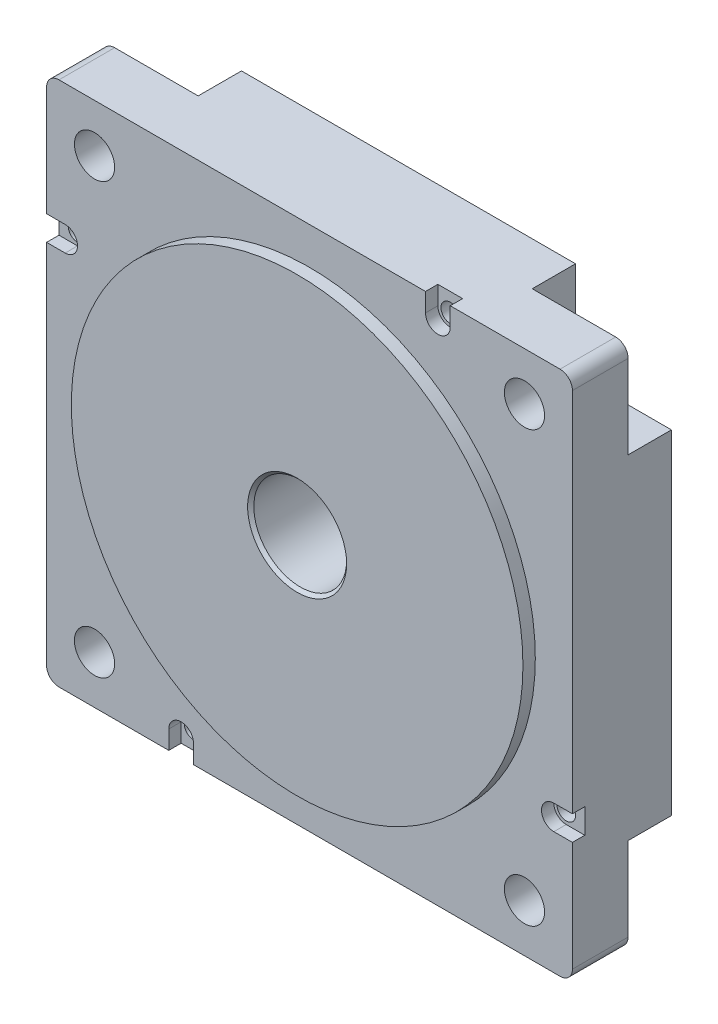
SolidWorks part; units mm, degrees
ref_plane "前视基准面" through (0, 0, 0) normal (0, 0, 1) x (1, 0, 0)
ref_plane "上视基准面" through (0, 0, 0) normal (0, 1, 0) x (1, 0, 0)
ref_plane "右视基准面" through (0, 0, 0) normal (1, 0, 0) x (0, 0, -1)
sketch "草图1" plane through (0, 0, 0) normal (0, 0, 1) x (1, 0, 0)
  line L0 (42.5, -37.5) -> (42.5, -42.5)
  line L1 (37.5, 42.5) -> (-37.5, 42.5)
  line L2 (42.5, 37.5) -> (42.5, -37.5)
  line L3 (37.5, -42.5) -> (-37.5, -42.5)
  line L4 (-42.5, 37.5) -> (-42.5, -37.5)
  line L5 (42.5, 42.5) -> (-42.5, -42.5) construction
  line L6 (42.5, -42.5) -> (-42.5, 42.5) construction
  line L7 (42.5, -42.5) -> (37.5, -42.5)
  line L8 (-37.5, -42.5) -> (-42.5, -42.5)
  line L9 (-42.5, -42.5) -> (-42.5, -37.5)
  line L10 (-37.5, 42.5) -> (-42.5, 42.5)
  line L11 (34.75, -34.75) -> (-34.75, -34.75) construction
  line L12 (34.75, -34.75) -> (34.75, 34.75) construction
  line L13 (34.75, 34.75) -> (-34.75, 34.75) construction
  line L14 (-34.75, -34.75) -> (-34.75, 34.75) construction
  line L15 (34.75, -34.75) -> (-34.75, 34.75) construction
  line L16 (34.75, 34.75) -> (-34.75, -34.75) construction
  line L17 (-42.5, 42.5) -> (-42.5, 37.5)
  line L18 (37.5, 42.5) -> (42.5, 42.5)
  line L19 (42.5, 42.5) -> (42.5, 37.5)
  circle A0 centre (-34.75, 34.75) radius 3.25
  circle A1 centre (-34.75, -34.75) radius 3.25
  circle A2 centre (34.75, -34.75) radius 3.25
  circle A3 centre (34.75, 34.75) radius 3.25
  point P0 (0, 0)
  point P14 (0, 0)
  dimension "D13" = 6.5
  dimension "D14" = 6.5
  dimension "D15" = 6.5
  dimension "D16" = 6.5
  dimension "D1" = 85
  dimension "D2" = 85
  dimension "D3" = 5
  dimension "D5" = 5
  dimension "D7" = 5
  dimension "D9" = 5
  dimension "D11" = 69.5
  dimension "D12" = 69.5
extrude "凸台-拉伸1" add sketch "草图1" along normal blind 16
sketch "草图2" plane through (0, 0, 16) normal (0, 0, 1) x (1, 0, 0)
  line L0 (-42.5, 22.75) -> (-39.5, 22.75)
  line L1 (22.75, -42.5) -> (-22.75, -42.5) construction
  line L2 (22.75, -42.5) -> (22.75, 42.5) construction
  line L3 (22.75, 42.5) -> (-22.75, 42.5) construction
  line L4 (-22.75, -42.5) -> (-22.75, 42.5) construction
  line L5 (22.75, -42.5) -> (-22.75, 42.5) construction
  line L6 (22.75, 42.5) -> (-22.75, -42.5) construction
  line L7 (42.5, -22.75) -> (-42.5, -22.75) construction
  line L8 (42.5, -22.75) -> (42.5, 22.75) construction
  line L9 (42.5, 22.75) -> (-42.5, 22.75) construction
  line L10 (-42.5, -22.75) -> (-42.5, 22.75) construction
  line L11 (42.5, -22.75) -> (-42.5, 22.75) construction
  line L12 (42.5, 22.75) -> (-42.5, -22.75) construction
  line L13 (-39.5, 18.75) -> (-42.5, 18.75)
  line L14 (-42.5, 18.75) -> (-42.5, 22.75)
  line L15 (-22.75, -42.5) -> (-22.75, -39.5)
  line L16 (-18.75, -39.5) -> (-18.75, -42.5)
  line L17 (-18.75, -42.5) -> (-22.75, -42.5)
  line L18 (42.5, -22.75) -> (39.5, -22.75)
  line L19 (39.5, -18.75) -> (42.5, -18.75)
  line L20 (42.5, -18.75) -> (42.5, -22.75)
  line L21 (22.75, 42.5) -> (22.75, 39.5)
  line L22 (18.75, 39.5) -> (18.75, 42.5)
  line L23 (18.75, 42.5) -> (22.75, 42.5)
  arc A0 (-39.5, 22.75) -> (-39.5, 18.75) centre (-39.5, 20.75) cw
  arc A1 (-22.75, -39.5) -> (-18.75, -39.5) centre (-20.75, -39.5) cw
  arc A2 (39.5, -22.75) -> (39.5, -18.75) centre (39.5, -20.75) cw
  arc A3 (22.75, 39.5) -> (18.75, 39.5) centre (20.75, 39.5) cw
  point P0 (0, 0)
  point P6 (0, 0)
  dimension "D1" = 45.5
  dimension "D2" = 85
  dimension "D3" = 45.5
  dimension "D4" = 85
  dimension "D5" = 3
  dimension "D6" = 4
  dimension "D7" = 4
  dimension "D8" = 3
  dimension "D9" = 3
  dimension "D10" = 4
  dimension "D11" = 3
  dimension "D12" = 4
extrude "切除-拉伸1" cut sketch "草图2" against normal blind 2
sketch "草图3" plane through (0, 0, 16) normal (0, 0, 1) x (1, 0, 0)
  line L0 (-42.5, 20.75) -> (-39.5, 20.75) construction
  line L1 (-42.5, 22.75) -> (-42.5, 18.75) construction
  line L2 (-20.75, -42.5) -> (-20.75, -39.5) construction
  line L3 (-22.75, -42.5) -> (-18.75, -42.5) construction
  line L4 (42.5, -20.75) -> (39.5, -20.75) construction
  line L5 (42.5, -22.75) -> (42.5, -18.75) construction
  line L6 (20.75, 42.5) -> (20.75, 39.5) construction
  line L7 (22.75, 42.5) -> (18.75, 42.5) construction
  circle A0 centre (-39.5, 20.75) radius 1.5
  circle A1 centre (-20.75, -39.5) radius 1.5
  circle A2 centre (39.5, -20.75) radius 1.5
  circle A3 centre (20.75, 39.5) radius 1.5
  dimension "D2" = 3
  dimension "D4" = 3
  dimension "D6" = 3
  dimension "D8" = 3
  dimension "D1" = 3
  dimension "D3" = 3
  dimension "D5" = 3
  dimension "D7" = 3
extrude "切除-拉伸2" cut sketch "草图3" against normal through all
sketch "草图4" plane through (0, 0, 16) normal (0, 0, 1) x (1, 0, 0)
  circle A0 centre (0, 0) radius 7.5
  dimension "D1" = 15
extrude "切除-拉伸3" cut sketch "草图4" against normal through all
sketch "草图5" plane through (0, 0, 16) normal (0, 0, 1) x (1, 0, 0)
  circle A0 centre (0, 0) radius 7.5
  circle A1 centre (0, 0) radius 36.5
  dimension "D1" = 73
  dimension "D2" = 15
extrude "凸台-拉伸2" add sketch "草图5" along normal blind 2
sketch "草图6" plane through (0, 0, 0) normal (0, 0, -1) x (-1, 0, 0)
  line L1 (-42.5, 42.5) -> (-27, 42.5)
  line L3 (-42.5, 42.5) -> (-42.5, 27)
  line L5 (-42.5, 27) -> (-27, 27)
  line L6 (-27, 42.5) -> (-27, 27)
extrude "切除-拉伸4" cut sketch "草图6" against normal blind 7
chamfer "倒角1" distance 0.5 angle 45 2 edges at (7.5, 0, 18) (7.5, 0, 0)
fillet "圆角1" radius 5 1 edges at (27, 27, 3.5)
fillet "圆角2" radius 2 4 edges at (42.5, -42.5, 8) (-42.5, -42.5, 8) (-42.5, 42.5, 8) (42.5, 42.5, 11.5)
pattern_circular "阵列(圆周)1" count 4 every 90 about axis through (0, 0, 0) along (0, 0, 1) of "切除-拉伸4", "圆角1"
